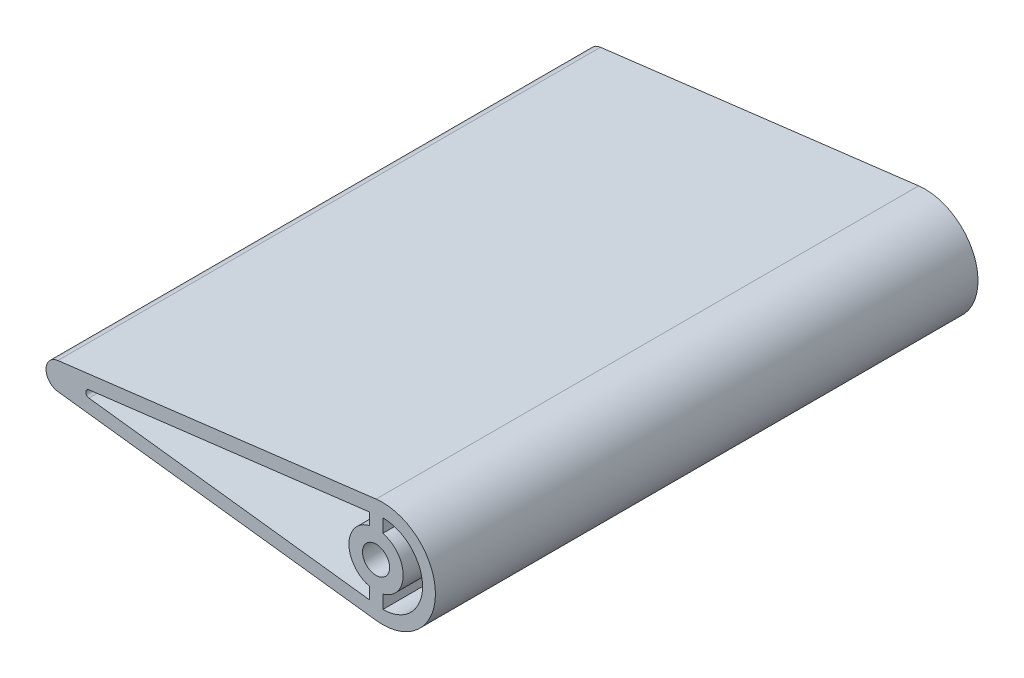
SolidWorks part; units mm, degrees
ref_plane "Plan de face" through (0, 0, 0) normal (0, 0, 1) x (1, 0, 0)
ref_plane "Plan de dessus" through (0, 0, 0) normal (0, 1, 0) x (1, 0, 0)
ref_plane "Plan de droite" through (0, 0, 0) normal (1, 0, 0) x (0, 0, -1)
sketch "Esquisse1" plane through (0, 0, 0) normal (0, 0, 1) x (1, 0, 0)
  line L0 (-107.1221, 0) -> (90.8098, 0) construction
  line L1 (-94.6165, 0) -> (0, 11.6174)
  line L3 (-63.497, 0.7985) -> (-1.5, 8.4107)
  line L5 (-1.5, 8.4107) -> (-1.5, 5.8095)
  line L6 (1.5, 8.7791) -> (1.5, 5.8095)
  line L8 (33.8874, -15.6785) -> (-61.9793, -15.6785) construction
  line L9 (-70, 0) -> (94.5503, -20.2042) construction
  line L10 (1.5, -8.7791) -> (1.5, -5.8095)
  line L11 (0, -19.8744) -> (0, 19.8744) construction
  line L12 (-1.5, -8.4107) -> (-1.5, -5.8095)
  line L14 (-63.497, -0.7985) -> (-1.5, -8.4107)
  line L15 (-94.6165, 0) -> (0, -11.6174)
  line L18 (-70, 0) -> (80.1602, 18.4373) construction
  circle A0 centre (0, 0) radius 3
  arc A1 (-1.5, 5.8095) -> (-1.5, -5.8095) centre (0, 0) ccw
  arc A2 (-63.497, -0.7985) -> (-63.497, 0.7985) centre (-63.3803, 0) cw
  arc A3 (1.5, -8.7791) -> (1.5, 8.7791) centre (1.5, 0) ccw
  arc A4 (0, 11.6174) -> (0, -11.6174) centre (1.4264, 0) cw
  arc A7 (1.5, -5.8095) -> (1.5, 5.8095) centre (0, 0) ccw
  point P4 (31.5, 0)
  point P30 (28.5, 0)
  dimension "D2" = 6
  dimension "D6" = 6
  dimension "D8" = 63.3803
  dimension "D9" = 0.8069
  dimension "D11" = 3
  dimension "D16" = 3
  dimension "D7" = 3
  dimension "D3" = 70
  dimension "D4" = 7
  dimension "D5" = 7
  dimension "D17" = 1.5
extrude "Boss.-Extru.1" add sketch "Esquisse1" along normal blind 120
fillet "Congé1" radius 3 1 edges at (-94.6165, 0, 60)
